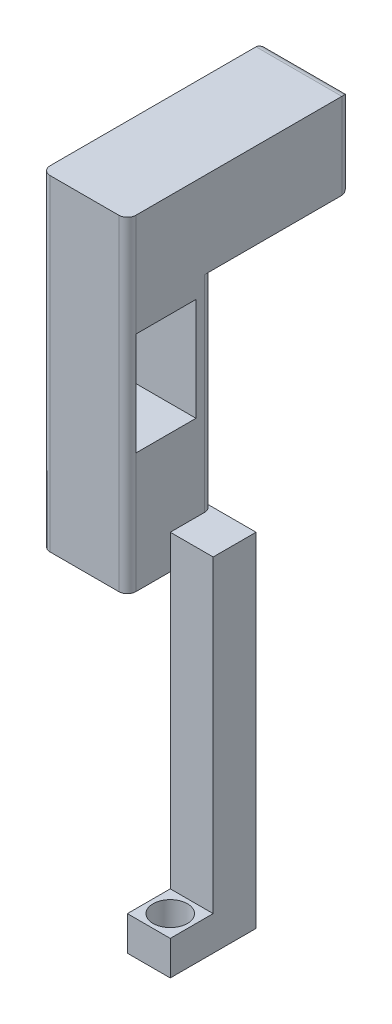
SolidWorks part; units mm, degrees
ref_plane "Front Plane" through (0, 0, 0) normal (0, 0, 1) x (1, 0, 0)
ref_plane "Top Plane" through (0, 0, 0) normal (0, 1, 0) x (1, 0, 0)
ref_plane "Right Plane" through (0, 0, 0) normal (1, 0, 0) x (0, 0, -1)
sketch "Sketch1" plane through (0, 0, 0) normal (0, 1, 0) x (1, 0, 0)
  line L1 (-3.75, 2.5) -> (3.75, 2.5)
  line L2 (-3.75, 2.5) -> (-3.75, -2.5)
  line L3 (-3.75, -2.5) -> (3.75, -2.5)
  line L4 (3.75, 2.5) -> (3.75, -2.5)
  line L5 (-3.75, 2.5) -> (3.75, -2.5) construction
  line L6 (-3.75, -2.5) -> (3.75, 2.5) construction
  point P0 (0, 0)
  dimension "D1" = 7.5
  dimension "D2" = 5
extrude "Boss-Extrude1" add sketch "Sketch1" along normal blind 2
sketch "Sketch2" plane through (0, 2, 0) normal (0, 1, 0) x (1, 0, 0)
  line L1 (-3.75, 2.5) -> (1.25, 2.5)
  line L2 (-3.75, 2.5) -> (-3.75, -2.5)
  line L3 (-3.75, -2.5) -> (1.25, -2.5)
  line L4 (3.75, -2.5) -> (3.75, 2.5)
  line L5 (3.75, 2.5) -> (-3.75, 2.5)
  line L6 (-3.75, 2.5) -> (-3.75, -2.5)
  line L7 (-3.75, -2.5) -> (3.75, -2.5)
  line L8 (3.75, -2.5) -> (3.75, 2.5)
  line L9 (3.75, 2.5) -> (-3.75, 2.5)
  line L10 (-3.75, 2.5) -> (-3.75, -2.5)
  line L11 (-3.75, -2.5) -> (3.75, -2.5)
  line L12 (1.25, 2.5) -> (1.25, -2.5)
  line L13 (-3.75, 2.5) -> (1.25, -2.5) construction
  line L14 (-3.75, -2.5) -> (1.25, 2.5) construction
  point P6 (-1.25, 0)
  dimension "D2" = 5
  dimension "D1" = 0
extrude "Boss-Extrude2" add sketch "Sketch2" along normal blind 17 contours L12 M7 M8 M9
sketch "Sketch3" plane through (0, 0, 0) normal (0, -1, 0) x (1, 0, 0)
  line L1 (3.75, 2.5) -> (1.25, 2.5)
  line L2 (3.75, 2.5) -> (3.75, -2.5)
  line L3 (3.75, -2.5) -> (1.25, -2.5)
  line L4 (3.75, -2.5) -> (3.75, 2.5)
  line L5 (3.75, 2.5) -> (-3.75, 2.5)
  line L6 (-3.75, 2.5) -> (-3.75, -2.5)
  line L7 (-3.75, -2.5) -> (3.75, -2.5)
  line L8 (3.75, -2.5) -> (3.75, 2.5)
  line L9 (3.75, 2.5) -> (-3.75, 2.5)
  line L10 (-3.75, 2.5) -> (-3.75, -2.5)
  line L11 (-3.75, -2.5) -> (3.75, -2.5)
  line L12 (1.25, 2.5) -> (1.25, -2.5)
  line L13 (3.75, 2.5) -> (1.25, -2.5) construction
  line L14 (3.75, -2.5) -> (1.25, 2.5) construction
  point P6 (2.5, 0)
  dimension "D2" = 2.5
  dimension "D1" = 0
extrude "Boss-Extrude3" add sketch "Sketch3" along normal blind 18 contours L12 M7 M9 M6
sketch "Sketch4" plane through (3.75, 0, 0) normal (1, 0, 0) x (0, 0, -1)
  line L1 (-2.5, 2) -> (0, 2)
  line L2 (-2.5, 2) -> (-2.5, -16)
  line L3 (-2.5, -16) -> (0, -16)
  line L4 (-2.5, 2) -> (-2.5, -18)
  line L5 (-2.5, -18) -> (2.5, -18)
  line L6 (2.5, -18) -> (2.5, 2)
  line L7 (2.5, 2) -> (-2.5, 2)
  line L8 (-2.5, 2) -> (-2.5, -18)
  line L9 (-2.5, -18) -> (2.5, -18)
  line L10 (2.5, -18) -> (2.5, 2)
  line L11 (2.5, 2) -> (-2.5, 2)
  line L12 (0, 2) -> (0, -16)
  line L13 (-2.5, 2) -> (0, -16) construction
  line L14 (-2.5, -16) -> (0, 2) construction
  point P7 (-1.25, -7)
  dimension "D2" = 2
  dimension "D1" = 0
extrude "Cut-Extrude1" cut sketch "Sketch4" against normal blind 2.5 contours L12 L3 M12 M9
sketch "Sketch5" plane through (0, -16, 0) normal (0, 1, 0) x (1, 0, 0)
  line L0 (1.25, -1.25) -> (3.75, -1.25) construction
  line L4 (3.75, -2.5) -> (3.75, 0)
  line L5 (3.75, 0) -> (1.25, 0)
  line L6 (1.25, 0) -> (1.25, -2.5)
  line L7 (1.25, -2.5) -> (3.75, -2.5)
  line L8 (3.75, -2.5) -> (3.75, 0)
  line L9 (3.75, 0) -> (1.25, 0)
  line L10 (1.25, 0) -> (1.25, -2.5)
  line L11 (1.25, -2.5) -> (3.75, -2.5)
  circle A0 centre (2.5, -1.25) radius 1
  dimension "D1" = 0
extrude "Cut-Extrude2" cut sketch "Sketch5" against normal blind 2.5 contours A0 L0 | L0 A0
sketch "Sketch6" plane through (0, 0, -2.5) normal (0, 0, -1) x (-1, 0, 0)
  line L1 (3.75, 19) -> (-1.25, 19)
  line L2 (3.75, 19) -> (3.75, 14)
  line L3 (3.75, 14) -> (-1.25, 14)
  line L4 (-1.25, 19) -> (-1.25, 14)
  line L5 (3.75, 19) -> (-1.25, 14) construction
  line L6 (3.75, 14) -> (-1.25, 19) construction
  line L8 (-3.75, 2) -> (-3.75, -18)
  line L9 (-3.75, -18) -> (-1.25, -18)
  line L10 (-1.25, -18) -> (-1.25, 0)
  line L11 (-1.25, 0) -> (3.75, 0)
  line L12 (3.75, 0) -> (3.75, 19)
  line L13 (3.75, 19) -> (-1.25, 19)
  line L14 (-1.25, 19) -> (-1.25, 2)
  line L15 (-1.25, 2) -> (-3.75, 2)
  line L16 (-3.75, 2) -> (-3.75, -18)
  line L17 (-3.75, -18) -> (-1.25, -18)
  line L18 (-1.25, -18) -> (-1.25, 0)
  line L19 (-1.25, 0) -> (3.75, 0)
  line L20 (3.75, 0) -> (3.75, 19)
  line L21 (3.75, 19) -> (-1.25, 19)
  line L22 (-1.25, 19) -> (-1.25, 2)
  line L23 (-1.25, 2) -> (-3.75, 2)
  point P6 (1.25, 16.5)
  dimension "D2" = 5
  dimension "D1" = 0
extrude "Boss-Extrude4" add sketch "Sketch6" along normal blind 8 contours L3 M14 M15 M16
fillet "Fillet1" radius 0.5 8 edges at (-1.25, 14, -10.5) (-3.75, 16.5, -10.5) (1.25, 16.5, -10.5) (-1.25, 19, -10.5) (1.25, 8, -2.5) (-3.75, 7, -2.5) (1.25, 9.5, 2.5) (-3.75, 9.5, 2.5)
sketch "Sketch7" plane through (-3.75, 0, 0) normal (-1, 0, 0) x (0, 0, 1)
  line L1 (2, 13) -> (-1.5, 13)
  line L2 (2, 13) -> (2, 7)
  line L3 (2, 7) -> (-1.5, 7)
  line L4 (-1.5, 13) -> (-1.5, 7)
  line L5 (2, 13) -> (-1.5, 7) construction
  line L6 (2, 19) -> (-10, 19)
  line L7 (-10, 19) -> (-10, 14)
  line L8 (-10, 14) -> (-2, 14)
  line L9 (-2, 14) -> (-2, 0)
  line L10 (-2, 0) -> (2, 0)
  line L11 (2, 0) -> (2, 19)
  line L12 (2, 19) -> (-10, 19)
  line L13 (-10, 19) -> (-10, 14)
  line L14 (-10, 14) -> (-2, 14)
  line L15 (-2, 14) -> (-2, 0)
  line L16 (-2, 0) -> (2, 0)
  line L17 (2, 0) -> (2, 19)
  line L18 (2, 7) -> (-1.5, 13) construction
  point P10 (0.25, 10)
  dimension "D2" = 6
  dimension "D3" = 6
  dimension "D4" = 3.5
  dimension "D1" = 0
extrude "Cut-Extrude3" cut sketch "Sketch7" against normal blind 8 contours L1 L4 L3 M15
